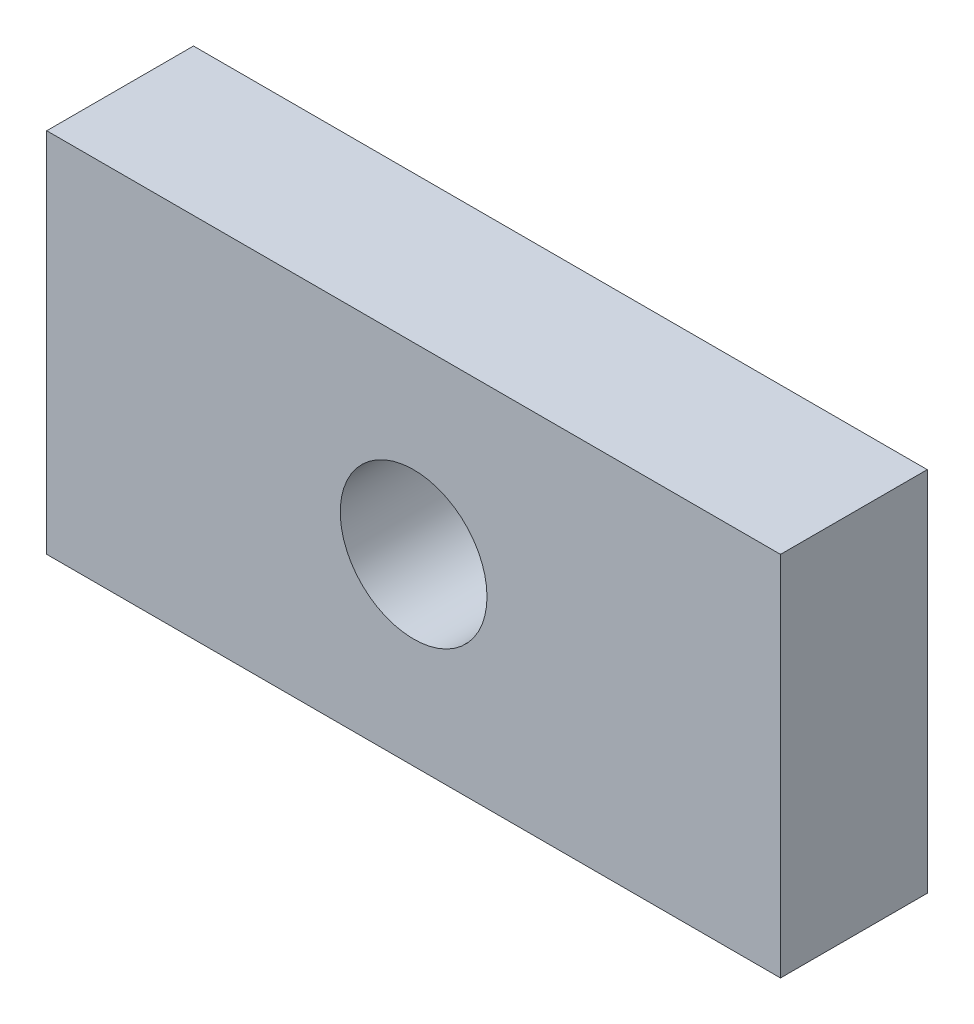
SolidWorks part; units mm, degrees
ref_plane "前视基准面" through (0, 0, 0) normal (0, 0, 1) x (1, 0, 0)
ref_plane "上视基准面" through (0, 0, 0) normal (0, 1, 0) x (1, 0, 0)
ref_plane "右视基准面" through (0, 0, 0) normal (1, 0, 0) x (0, 0, -1)
other "Configuration Table"
sketch "草图1" plane through (0, 0, 0) normal (0, 0, 1) x (1, 0, 0)
  line L1 (-50, -25) -> (50, -25)
  line L2 (-50, -25) -> (-50, 25)
  line L3 (-50, 25) -> (50, 25)
  line L4 (50, -25) -> (50, 25)
  line L5 (-50, -25) -> (50, 25) construction
  line L6 (-50, 25) -> (50, -25) construction
  point P0 (0, 0)
extrude "凸台-拉伸1" add sketch "草图1" against normal blind 20
sketch "草图2" plane through (0, 0, 0) normal (0, 0, 1) x (1, 0, 0)
  circle A0 centre (0, 0) radius 10
extrude "切除-拉伸1" cut sketch "草图2" against normal blind 20
